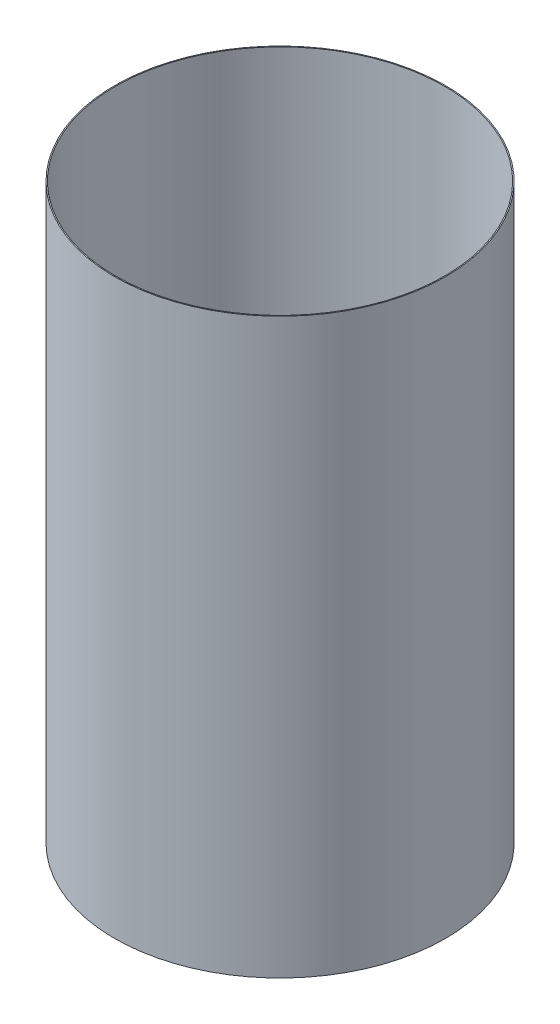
SolidWorks part; units mm, degrees
ref_plane "Face" through (0, 0, 0) normal (0, 0, 1) x (1, 0, 0)
ref_plane "Dessus" through (0, 0, 0) normal (0, 1, 0) x (1, 0, 0)
ref_plane "Droite" through (0, 0, 0) normal (1, 0, 0) x (0, 0, -1)
sketch "Esquisse1" plane through (0, 0, 0) normal (0, 1, 0) x (1, 0, 0)
  circle A0 centre (0, 0) radius 48.5
extrude "Extru.-Mince1" add sketch "Esquisse1" along normal blind 169 thin
